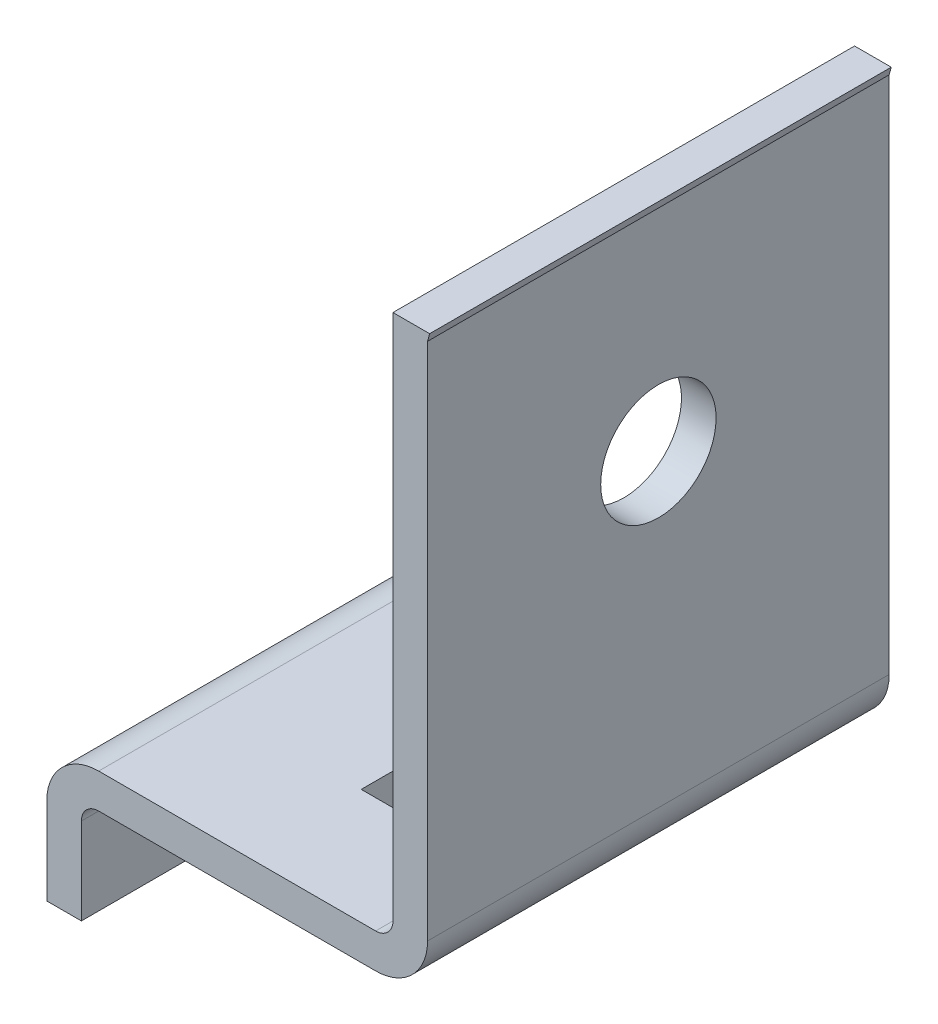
SolidWorks part; units mm, degrees
ref_plane "Front" through (0, 0, 0) normal (0, 0, 1) x (1, 0, 0)
ref_plane "Top" through (0, 0, 0) normal (0, 1, 0) x (1, 0, 0)
ref_plane "Right" through (0, 0, 0) normal (1, 0, 0) x (0, 0, -1)
sketch "Esquisse1" plane through (0, 0, 0) normal (0, 0, 1) x (1, 0, 0)
  line L0 (0, 0) -> (6, 0)
  line L1 (6, 0) -> (6, 12)
  line L2 (9, 18) -> (57, 18)
  line L3 (66, 30) -> (66, 117)
  line L4 (0, 0) -> (0, 12)
  line L5 (13.4946, 24) -> (48, 24)
  line L6 (60, 30) -> (60, 118.608)
  line L7 (66, 117) -> (84.7644, 187.0296)
  line L8 (84.7644, 187.0296) -> (78.9688, 188.5825)
  line L9 (78.9688, 188.5825) -> (60, 118.608)
  line L10 (12, 24) -> (13.4946, 24)
  line L11 (12, 24) -> (9, 24)
  line L12 (0, 15) -> (0, 12)
  line L14 (60, 30) -> (60, 27)
  line L16 (66, 30) -> (66, 27)
  line L17 (48, 24) -> (57, 24)
  line L18 (6, 15) -> (6, 12)
  arc A0 (57, 24) -> (60, 27) centre (57, 27) ccw
  arc A1 (57, 18) -> (66, 27) centre (57, 27) ccw
  arc A2 (9, 24) -> (0, 15) centre (9, 15) ccw
  arc A3 (9, 18) -> (6, 15) centre (9, 15) ccw
  point P12 (0, 24)
  point P15 (60, 18)
  point P18 (6, 18)
  point P21 (60, 24)
  dimension "D7" = 6
  dimension "D9" = 18
  dimension "D13" = 6
  dimension "D14" = 18
  dimension "Epaisseur" = 6
  dimension "D2" = 18
  dimension "D3" = 54
  dimension "hauteur de patte" = 24
  dimension "D6" = 66
  dimension "angle de pliage" = 165
  dimension "hauteur aprés plis" = 72.5
  dimension "hauteur sous plis" = 93
  dimension "D15" = 3
  dimension "D16" = 3
  dimension "D17" = 3
  dimension "D18" = 3
extrude "corps" add sketch "Esquisse1" against normal blind 80
chamfer "Chanfrein1" distance 15 angle 45 1 edges at (81.8666, 187.8061, 0)
chamfer "Chanfrein2" distance 15 angle 45 1 edges at (81.8666, 187.8061, -80)
sketch "Esquisse2" plane through (25.9412, -7.0322, 0) normal (-0.9652, 0.2616, 0) x (0, 0, 1)
  line L0 (-19.3296, 177.6747) -> (-61.0149, 177.6747) construction
  line L1 (-40, 192.6909) -> (-40, 150.4889) construction
  line L2 (0, 187.6747) -> (0, 130.1747) construction
  line L3 (-65, 202.6747) -> (-15, 202.6747) construction
  line L4 (-32.5, 187.6747) -> (-32.5, 167.6747)
  line L5 (-47.5, 187.6747) -> (-47.5, 167.6747)
  arc A0 (-47.5, 167.6747) -> (-32.5, 167.6747) centre (-40, 177.6747) ccw
  arc A1 (-32.5, 187.6747) -> (-47.5, 187.6747) centre (-40, 177.6747) ccw
  dimension "D1" = 25
  dimension "D2" = 40
  dimension "D3" = 25
  dimension "D4" = 15
  dimension "D5" = 7.5
extrude "trou oublon" cut sketch "Esquisse2" against normal blind 50
sketch "Esquisse3" plane through (25.9412, -7.0322, 0) normal (-0.9652, 0.2616, 0) x (0, 0, 1)
  line L0 (-3.8492, 142.6747) -> (-25.7253, 142.6747) construction
  line L1 (-8.5, 149.1747) -> (-21.5, 149.1747)
  line L2 (-8.5, 149.1747) -> (-8.5, 136.1747)
  line L3 (-8.5, 136.1747) -> (-21.5, 136.1747)
  line L4 (-21.5, 149.1747) -> (-21.5, 136.1747)
  line L5 (-58.5, 149.1747) -> (-71.5, 149.1747)
  line L6 (-58.5, 149.1747) -> (-58.5, 136.1747)
  line L7 (-58.5, 136.1747) -> (-71.5, 136.1747)
  line L8 (-71.5, 149.1747) -> (-71.5, 136.1747)
  line L9 (-54.1937, 142.6747) -> (-72.4525, 142.6747) construction
  line L10 (-15, 153.5894) -> (-15, 135.3306) construction
  line L11 (-65, 153.5894) -> (-65, 135.3306) construction
  line L12 (-80, 187.6747) -> (-80, 130.1747) construction
  line L13 (-65, 202.6747) -> (-15, 202.6747) construction
  dimension "D1" = 13
  dimension "D2" = 13
  dimension "D3" = 6.5
  dimension "D4" = 13
  dimension "D5" = 13
  dimension "D6" = 6.5
  dimension "D7" = 6.5
  dimension "D8" = 6.5
  dimension "D9" = 50
  dimension "D10" = 15
  dimension "D11" = 60
  dimension "D12" = 60
extrude "trou de fixation" cut sketch "Esquisse3" against normal blind 50
sketch "Esquisse4" plane through (60, 0, 0) normal (-1, 0, 0) x (0, 0, 1)
  line L0 (-27.0588, 80.5) -> (-51.078, 80.5) construction
  line L5 (-40, 85.9203) -> (-40, 63.1673) construction
  line L6 (-80, 24) -> (0, 24) construction
  line L8 (0, 118.608) -> (0, 27) construction
  circle A0 centre (-40, 80.5) radius 10
  dimension "D1" = 20
  dimension "D5" = 56.5
  dimension "D6" = 40
extrude "trou de fixation des renforts" cut sketch "Esquisse4" against normal blind 10
sketch "Esquisse5" plane through (0, 24, 0) normal (0, 1, 0) x (-1, 0, 0)
  line L0 (-41, -63.6483) -> (-41, -10.1375) construction
  line L1 (-47.5, -60) -> (-34.5, -60)
  line L2 (-47.5, -60) -> (-47.5, -20)
  line L3 (-47.5, -20) -> (-34.5, -20)
  line L4 (-34.5, -60) -> (-34.5, -20)
  line L5 (-41.022, -40) -> (-19.3588, -40) construction
  line L6 (-57, 0) -> (-9, 0) construction
  line L8 (0, -80) -> (0, 0) construction
  dimension "D1" = 40
  dimension "D2" = 13
  dimension "D3" = 40
  dimension "D4" = 20
  dimension "D5" = 6.5
  dimension "D6" = 41
extrude "trou de fixation sur chassis" cut sketch "Esquisse5" against normal blind 10
sketch "Esquisse6" plane through (60, 0, 0) normal (-1, 0, 0) x (0, 0, 1)
  line L1 (-101.6935, 118.323) -> (23.1282, 118.323)
  line L2 (-101.6935, 118.323) -> (-101.6935, 202.6136)
  line L3 (-101.6935, 202.6136) -> (23.1282, 202.6136)
  line L4 (23.1282, 118.323) -> (23.1282, 202.6136)
extrude "Enlèv. mat.-Extru.1" cut sketch "Esquisse6" against normal through all
